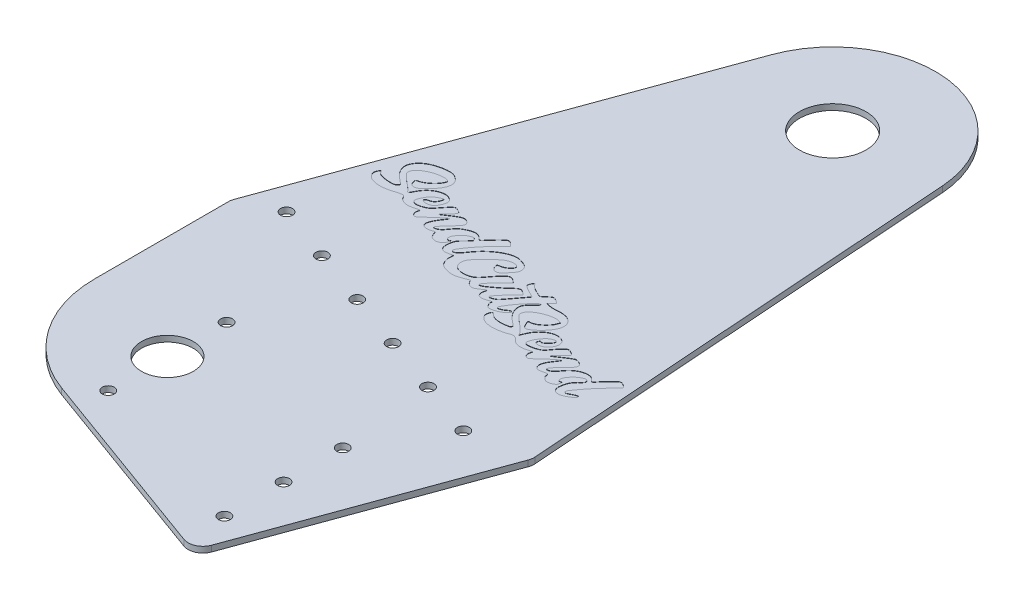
SolidWorks part; units mm, degrees
ref_plane "Front Plane" through (0, 0, 0) normal (0, 0, 1) x (1, 0, 0)
ref_plane "Top Plane" through (0, 0, 0) normal (0, 1, 0) x (1, 0, 0)
ref_plane "Right Plane" through (0, 0, 0) normal (1, 0, 0) x (0, 0, -1)
sketch "Sketch1" plane through (0, 0, 0) normal (0, 1, 0) x (1, 0, 0)
  line L2 (0, 79.9615) -> (0, 137.226)
  line L3 (160.847, 106.8323) -> (8.6873, 162.2139) construction
  line L9 (124.1351, 5.967) -> (160.3844, 105.5611)
  line L11 (0, 138.3457) -> (152.1597, 82.9641) construction
  line L12 (4.3437, 150.2798) -> (156.5034, 94.8982) construction
  line L13 (116.079, 82.9641) -> (116.079, 0) construction
  line L14 (128.779, 6.7641) -> (103.379, 6.7641) construction
  line L15 (128.779, 6.7641) -> (128.779, 82.9641) construction
  line L16 (128.779, 82.9641) -> (103.379, 82.9641) construction
  line L17 (103.379, 6.7641) -> (103.379, 82.9641) construction
  line L18 (128.779, 6.7641) -> (103.379, 82.9641) construction
  line L19 (128.779, 82.9641) -> (103.379, 6.7641) construction
  line L20 (0.383, 139.3979) -> (8.6873, 162.2139)
  line L21 (8.6873, 162.2139) -> (61.8971, 308.4066)
  line L22 (147.4128, 296.4285) -> (160.7514, 108.1817)
  line L23 (33.4254, 32.2252) -> (115.9962, 2.1718)
  line L24 (0, 0) -> (121.9633, 0) construction
  circle A0 centre (103.379, 293.3084) radius 14.2875
  circle A1 centre (44.45, 66.6217) radius 11.1125
  circle A2 centre (44.45, 66.6217) radius 25.4 construction
  circle A3 centre (44.45, 92.0217) radius 2.5527
  circle A4 centre (44.45, 41.2217) radius 2.5527
  circle A5 centre (44.45, 66.6217) radius 31.75 construction
  arc A6 (147.4128, 296.4285) -> (61.8971, 308.4066) centre (103.379, 293.3084) ccw
  arc A9 (0.383, 139.3979) -> (0, 137.226) centre (6.35, 137.226) ccw
  arc A10 (160.3844, 105.5611) -> (160.7514, 108.1817) centre (154.4173, 107.7329) ccw
  arc A11 (115.9962, 2.1718) -> (124.1351, 5.967) centre (118.168, 8.1389) ccw
  arc A12 (0, 79.9615) -> (33.4254, 32.2252) centre (50.8, 79.9615) ccw
  point P3 (111.7505, 111.1869)
  point P14 (135.6187, 102.4996)
  point P20 (116.079, 44.8641)
  point P24 (87.8823, 119.8742)
  point P26 (64.0141, 128.5615)
  point P28 (40.1459, 137.2488)
  point P29 (116.079, 19.4641)
  point P32 (16.2778, 145.9362)
  point P42 (0, 0)
  point P49 (116.079, 70.2641)
  dimension "D2" = 28.575
  dimension "D3" = 22.225
  dimension "D4" = 50.8
  dimension "D5" = 5.1054
  dimension "D21" = 63.5
  dimension "D22" = 6.35
  dimension "D26" = 50.8
  dimension "D6" = 20
  dimension "D7" = 25.4
  dimension "D8" = 23.3807
  dimension "D9" = 161.925
  dimension "D10" = 25.4
  dimension "D11" = 12.7
  dimension "D12" = 155.575
  dimension "D13" = 25.4
  dimension "D14" = 25.4
  dimension "D15" = 25.4
  dimension "D16" = 25.4
  dimension "D17" = 234.221
  dimension "D18" = 44.45
  dimension "D19" = 25.4
  dimension "D20" = 76.2
  dimension "D23" = 25.4
  dimension "D24" = 25.4
  dimension "D25" = 12.7
  dimension "D27" = 77.5957
extrude "Boss-Extrude1" add sketch "Sketch1" along normal blind 2.54
hole_wizard "#7 (0.201) Diameter Hole1" positions "Sketch2" profile "Sketch3" hole size "#7" standard "ANSI Inch"
sketch "Sketch2" plane through (0, 0, 0) normal (0, -1, 0) x (-1, 0, 0)
  point P0 (-135.6187, 102.4996)
  point P3 (-111.7505, 111.1869)
  point P6 (-87.8823, 119.8742)
  point P9 (-64.0141, 128.5615)
  point P12 (-40.1459, 137.2488)
  point P15 (-16.2778, 145.9362)
  point P18 (-116.079, 70.2641)
  point P21 (-116.079, 44.8641)
  point P24 (-116.079, 19.4641)
sketch "Sketch3" plane through (135.6187, 0, -102.4996) normal (1, 0, 0) x (0, 0, -1)
  line L0 (0, 0) -> (0, 2.54)
  line L1 (0, 2.54) -> (2.5527, 2.54)
  line L2 (2.5527, 2.54) -> (2.5527, 0)
  line L5 (2.5527, 0) -> (0, 0)
  line L11 (0, -6.35) -> (0, 107.95) construction
  dimension "Thru Hole Dia." = 5.1054
  dimension "Thru Hole Depth" = 2.54
sketch "Sketch7" plane through (0, 2.54, 0) normal (0, 1, 0) x (1, 0, 0)
  line L0 (62.0761, 169.3899) -> (62.5144, 170.567)
  line L1 (62.5144, 170.567) -> (61.5867, 170.2622)
  line L2 (66.9677, 175.195) -> (66.4796, 174.6886)
  line L3 (79.1731, 159.2722) -> (81.2123, 160.0556)
  line L4 (81.2123, 160.0556) -> (81.5639, 159.3016)
  line L5 (115.2098, 163.8413) -> (116.357, 163.4486)
  line L6 (116.357, 163.4486) -> (115.8813, 162.1889)
  line L7 (107.7827, 167.4695) -> (106.2875, 167.7994)
  line L8 (106.2875, 167.7994) -> (107.2664, 168.7114)
  line L9 (96.7548, 171.953) -> (96.1723, 172.7991)
  line L10 (96.1723, 172.7991) -> (95.6669, 171.9454)
  line L11 (100.3403, 166.7321) -> (97.6686, 163.2228)
  line L12 (89.4476, 166.3552) -> (91.3642, 168.2161)
  line L13 (91.3642, 168.2161) -> (90.6316, 168.886)
  line L14 (14.1169, 177.1315) -> (159.6183, 124.1733) construction
  line L15 (61.8971, 308.4066) -> (0.383, 139.3979) construction
  line L16 (160.7514, 108.1817) -> (147.4128, 296.4285) construction
  line L17 (33.4254, 32.2252) -> (115.9962, 2.1718) construction
  arc A0 (74.3082, 182.8504) -> (73.725, 182.5147) centre (74.7103, 181.4774) ccw
  arc A1 (73.725, 182.5147) -> (72.1718, 181.0017) centre (133.1992, 119.9033) ccw
  arc A2 (72.1718, 181.0017) -> (70.5314, 179.2921) centre (111.5899, 141.5378) ccw
  arc A3 (70.5314, 179.2921) -> (69.0762, 177.6244) centre (101.8392, 150.5038) ccw
  arc A4 (68.547, 177.0625) -> (69.0762, 177.6244) centre (64.4257, 181.474) ccw
  arc A5 (68.1985, 176.9514) -> (68.547, 177.0625) centre (68.2556, 177.3744) ccw
  arc A6 (67.7948, 177.1281) -> (68.1985, 176.9514) centre (68.3059, 177.7466) ccw
  arc A7 (66.8738, 177.9219) -> (67.7948, 177.1281) centre (86.4277, 199.6753) ccw
  arc A8 (66.8738, 177.9219) -> (65.9604, 178.4972) centre (64.7429, 175.5513) ccw
  arc A9 (65.9604, 178.4972) -> (64.9049, 178.7371) centre (64.7273, 175.5134) ccw
  arc A10 (64.9049, 178.7371) -> (63.6726, 178.6312) centre (64.6624, 174.336) ccw
  arc A11 (63.6726, 178.6312) -> (62.2317, 178.1778) centre (65.8385, 169.232) ccw
  arc A12 (62.2317, 178.1778) -> (60.6707, 177.4551) centre (68.6224, 162.3269) ccw
  arc A13 (60.6707, 177.4551) -> (59.5301, 176.703) centre (63.8858, 171.3384) ccw
  arc A14 (59.5301, 176.703) -> (58.5257, 175.7167) centre (64.2391, 170.9033) ccw
  arc A15 (58.5257, 175.7167) -> (57.3864, 174.2438) centre (75.6018, 161.3305) ccw
  arc A16 (56.7062, 173.3435) -> (57.3864, 174.2438) centre (42.2162, 184.9983) ccw
  arc A17 (56.1228, 172.7101) -> (56.7062, 173.3435) centre (51.6914, 177.3771) ccw
  arc A18 (55.5639, 172.2634) -> (56.1228, 172.7101) centre (53.2294, 175.7573) ccw
  arc A19 (54.9666, 171.9461) -> (55.5639, 172.2634) centre (53.6962, 175.0587) ccw
  arc A20 (54.5243, 171.7924) -> (54.9666, 171.9461) centre (53.293, 176.0466) ccw
  arc A21 (54.1163, 171.7066) -> (54.5243, 171.7924) centre (53.7472, 174.4772) ccw
  arc A22 (53.7901, 171.6904) -> (54.1163, 171.7066) centre (53.8553, 173.6659) ccw
  arc A23 (53.635, 171.7688) -> (53.7901, 171.6904) centre (53.7969, 171.8965) ccw
  arc A24 (53.5905, 172.1698) -> (53.635, 171.7688) centre (53.9344, 172.005) ccw
  arc A25 (54.0093, 172.8651) -> (53.5905, 172.1698) centre (57.4392, 170.3253) ccw
  arc A26 (54.9177, 173.9796) -> (54.0093, 172.8651) centre (66.4395, 163.6605) ccw
  arc A27 (56.8324, 176.0866) -> (54.9177, 173.9796) centre (201.8255, 42.4065) ccw
  arc A28 (56.8324, 176.0866) -> (58.6294, 178.1211) centre (10.0366, 219.2312) ccw
  arc A29 (58.6294, 178.1211) -> (59.308, 179.2325) centre (55.3883, 180.8631) ccw
  arc A30 (59.308, 179.2325) -> (59.3329, 180.0542) centre (58.2421, 179.6759) ccw
  arc A31 (59.3329, 180.0542) -> (58.8124, 180.8462) centre (57.5061, 179.4207) ccw
  arc A32 (58.8124, 180.8462) -> (57.7553, 181.5045) centre (56.5222, 178.3469) ccw
  arc A33 (57.7553, 181.5045) -> (56.6586, 181.6278) centre (56.9757, 179.5081) ccw
  arc A34 (56.6586, 181.6278) -> (55.3092, 181.1821) centre (57.2782, 177.4858) ccw
  arc A35 (55.3092, 181.1821) -> (53.3754, 180.0329) centre (66.6249, 159.9392) ccw
  arc A36 (50.4555, 178.11) -> (53.3754, 180.0329) centre (-1623.116, 2722.5471) ccw
  arc A37 (49.9624, 177.8143) -> (50.4555, 178.11) centre (46.648, 183.8988) ccw
  arc A38 (49.9101, 177.875) -> (49.9624, 177.8143) centre (49.9428, 177.8503) ccw
  arc A39 (50.3128, 178.3647) -> (49.9101, 177.875) centre (56.008, 173.2696) ccw
  arc A40 (50.6868, 178.776) -> (50.3128, 178.3647) centre (76.0211, 155.3656) ccw
  arc A41 (51.2355, 179.3665) -> (50.6868, 178.776) centre (157.5463, 80.0316) ccw
  arc A42 (51.843, 180.0132) -> (51.2355, 179.3665) centre (169.196, 69.1464) ccw
  arc A43 (52.4254, 180.6256) -> (51.843, 180.0132) centre (148.4427, 88.7526) ccw
  arc A44 (52.4254, 180.6256) -> (53.4057, 181.7377) centre (39.3118, 193.1732) ccw
  arc A45 (53.4057, 181.7377) -> (53.5985, 182.3391) centre (52.73, 182.286) ccw
  arc A46 (53.5985, 182.3391) -> (53.3133, 182.8365) centre (52.9532, 182.2996) ccw
  arc A47 (53.3133, 182.8365) -> (52.2525, 183.4524) centre (48.0293, 174.9565) ccw
  arc A48 (52.2525, 183.4524) -> (51.5201, 183.784) centre (47.2947, 173.4787) ccw
  arc A49 (51.5201, 183.784) -> (51.1138, 183.8533) centre (51.1621, 182.911) ccw
  arc A50 (51.1138, 183.8533) -> (50.7464, 183.7367) centre (51.1527, 183.0936) ccw
  arc A51 (50.7464, 183.7367) -> (50.2, 183.3471) centre (53.9544, 178.6599) ccw
  arc A52 (50.2, 183.3471) -> (49.7518, 182.9327) centre (52.8985, 179.9782) ccw
  arc A53 (49.7518, 182.9327) -> (49.0516, 182.1629) centre (73.6142, 160.5277) ccw
  arc A54 (49.0516, 182.1629) -> (48.2702, 181.2458) centre (76.593, 157.9039) ccw
  arc A55 (48.2702, 181.2458) -> (47.5086, 180.2915) centre (78.2622, 156.5282) ccw
  arc A56 (46.4851, 179.0185) -> (47.5086, 180.2915) centre (14.0592, 206.1378) ccw
  arc A57 (45.7613, 178.2653) -> (46.4851, 179.0185) centre (40.6676, 183.884) ccw
  arc A58 (45.0854, 177.7635) -> (45.7613, 178.2653) centre (42.8654, 181.4597) ccw
  arc A59 (44.2716, 177.3569) -> (45.0854, 177.7635) centre (42.0649, 182.7925) ccw
  arc A60 (42.4079, 176.7566) -> (44.2716, 177.3569) centre (39.29, 189.6277) ccw
  arc A61 (40.9063, 176.6373) -> (42.4079, 176.7566) centre (41.2837, 181.3973) ccw
  arc A62 (39.9018, 176.9889) -> (40.9063, 176.6373) centre (41.0714, 178.7199) ccw
  arc A63 (39.431, 177.7408) -> (39.9018, 176.9889) centre (40.5148, 177.8961) ccw
  arc A64 (39.5246, 178.6802) -> (39.431, 177.7408) centre (41.3834, 178.0206) ccw
  arc A65 (40.1422, 180.1498) -> (39.5246, 178.6802) centre (52.749, 173.9875) ccw
  arc A66 (40.967, 181.6069) -> (40.1422, 180.1498) centre (52.5933, 174.0636) ccw
  arc A67 (41.8093, 182.6065) -> (40.967, 181.6069) centre (45.3757, 178.7465) ccw
  arc A68 (42.735, 183.3116) -> (41.8093, 182.6065) centre (45.9761, 178.0966) ccw
  arc A69 (43.9637, 183.9848) -> (42.735, 183.3116) centre (49.4769, 172.4638) ccw
  arc A70 (45.1396, 184.492) -> (43.9637, 183.9848) centre (51.0302, 169.2179) ccw
  arc A71 (45.4706, 184.3586) -> (45.1396, 184.492) centre (45.2337, 184.2481) ccw
  arc A72 (45.4918, 184.1987) -> (45.4706, 184.3586) centre (45.2267, 184.2448) ccw
  arc A73 (45.4167, 183.8436) -> (45.4918, 184.1987) centre (40.5531, 185.0579) ccw
  arc A74 (45.2918, 183.4176) -> (45.4167, 183.8436) centre (40.1115, 185.1681) ccw
  arc A75 (45.1216, 182.9606) -> (45.2918, 183.4176) centre (37.7577, 185.9635) ccw
  arc A76 (44.6747, 182.1439) -> (45.1216, 182.9606) centre (41.315, 184.5129) ccw
  arc A77 (44.0662, 181.4742) -> (44.6747, 182.1439) centre (41.6698, 184.2628) ccw
  arc A78 (43.3406, 180.9981) -> (44.0662, 181.4742) centre (41.872, 184.0274) ccw
  arc A79 (42.5496, 180.7503) -> (43.3406, 180.9981) centre (42.1132, 183.5299) ccw
  arc A80 (42.5496, 180.7503) -> (42.0333, 180.6322) centre (43.1444, 176.9613) ccw
  arc A81 (42.0333, 180.6322) -> (41.6424, 180.4565) centre (42.5179, 179.0313) ccw
  arc A82 (41.6424, 180.4565) -> (41.3631, 180.2173) centre (42.2562, 179.4572) ccw
  arc A83 (41.3631, 180.2173) -> (41.1817, 179.91) centre (42.1574, 179.5413) ccw
  arc A84 (41.1817, 179.91) -> (41.3098, 179.5404) centre (41.4675, 179.802) ccw
  arc A85 (41.3098, 179.5404) -> (42.0184, 179.2356) centre (42.7766, 181.9744) ccw
  arc A86 (42.0184, 179.2356) -> (42.9911, 179.0785) centre (43.2169, 183.5653) ccw
  arc A87 (42.9911, 179.0785) -> (43.9333, 179.1484) centre (43.1825, 182.8819) ccw
  arc A88 (43.9333, 179.1484) -> (44.9037, 179.5156) centre (43.3041, 182.2773) ccw
  arc A89 (44.9037, 179.5156) -> (45.7482, 180.1858) centre (43.0455, 182.7238) ccw
  arc A90 (45.7482, 180.1858) -> (46.4656, 181.1717) centre (42.1809, 183.5357) ccw
  arc A91 (46.4656, 181.1717) -> (47.0588, 182.4767) centre (38.3652, 185.6409) ccw
  arc A92 (47.0588, 182.4767) -> (47.3717, 183.6741) centre (40.8285, 184.7444) ccw
  arc A93 (47.3717, 183.6741) -> (47.3128, 184.5787) centre (45.3846, 183.9991) ccw
  arc A94 (47.3128, 184.5787) -> (46.8711, 185.315) centre (45.6402, 184.0759) ccw
  arc A95 (46.8711, 185.315) -> (46.0042, 185.9854) centre (43.743, 182.166) ccw
  arc A96 (46.0042, 185.9854) -> (43.5248, 186.5796) centre (43.802, 182.2657) ccw
  arc A97 (43.5248, 186.5796) -> (40.6936, 185.808) centre (43.994, 179.2776) ccw
  arc A98 (40.6936, 185.808) -> (38.0435, 183.8254) centre (44.996, 177.2948) ccw
  arc A99 (38.0435, 183.8254) -> (36.1073, 180.9839) centre (46.1106, 176.2478) ccw
  arc A100 (35.7666, 180.3077) -> (36.1073, 180.9839) centre (22.1662, 187.5841) ccw
  arc A101 (35.4405, 179.7525) -> (35.7666, 180.3077) centre (28.6157, 184.1336) ccw
  arc A102 (35.1529, 179.3322) -> (35.4405, 179.7525) centre (28.1525, 184.4309) ccw
  arc A103 (35.0212, 179.292) -> (35.1529, 179.3322) centre (35.0603, 179.3996) ccw
  arc A104 (34.8987, 179.3634) -> (35.0212, 179.292) centre (35.1574, 179.6664) ccw
  arc A105 (34.7135, 179.5337) -> (34.8987, 179.3634) centre (37.1267, 181.9726) ccw
  arc A106 (34.5102, 179.7505) -> (34.7135, 179.5337) centre (37.4991, 182.3489) ccw
  arc A107 (34.3152, 179.9906) -> (34.5102, 179.7505) centre (38.0148, 182.7973) ccw
  arc A108 (34.3152, 179.9906) -> (33.9923, 180.3441) centre (32.2157, 178.3978) ccw
  arc A109 (33.9923, 180.3441) -> (33.1472, 181.1013) centre (-7.0589, 135.3727) ccw
  arc A110 (33.1472, 181.1013) -> (32.12, 181.9836) centre (-5.5235, 137.119) ccw
  arc A111 (32.12, 181.9836) -> (30.9902, 182.914) centre (-19.1906, 120.8302) ccw
  arc A112 (29.8644, 183.859) -> (30.9902, 182.914) centre (55.91, 213.7448) ccw
  arc A113 (28.849, 184.7853) -> (29.8644, 183.859) centre (49.7895, 206.7219) ccw
  arc A114 (28.0329, 185.5958) -> (28.849, 184.7853) centre (48.8821, 205.7713) ccw
  arc A115 (27.72, 186.0357) -> (28.0329, 185.5958) centre (29.3248, 186.846) ccw
  arc A116 (27.5634, 187.404) -> (27.72, 186.0357) centre (29.4953, 186.932) ccw
  arc A117 (28.2937, 188.8328) -> (27.5634, 187.404) centre (30.9404, 186.579) ccw
  arc A118 (29.9235, 190.2307) -> (28.2937, 188.8328) centre (33.5403, 184.365) ccw
  arc A119 (32.3635, 191.4887) -> (29.9235, 190.2307) centre (39.3462, 174.9492) ccw
  arc A120 (34.2055, 192.0999) -> (32.3635, 191.4887) centre (37.1375, 180.1808) ccw
  arc A121 (36.2347, 192.4587) -> (34.2055, 192.0999) centre (37.9264, 176.974) ccw
  arc A122 (38.0495, 192.5388) -> (36.2347, 192.4587) centre (37.761, 178.4879) ccw
  arc A123 (39.0536, 192.2197) -> (38.0495, 192.5388) centre (38.0113, 190.6797) ccw
  arc A124 (39.401, 191.9318) -> (39.0536, 192.2197) centre (37.7469, 190.289) ccw
  arc A125 (39.5146, 191.678) -> (39.401, 191.9318) centre (39.1218, 191.6545) ccw
  arc A126 (39.4565, 191.3418) -> (39.5146, 191.678) centre (38.7713, 191.6335) ccw
  arc A127 (39.1465, 190.6692) -> (39.4565, 191.3418) centre (27.8847, 196.2671) ccw
  arc A128 (38.0069, 188.9592) -> (39.1465, 190.6692) centre (31.8572, 194.2925) ccw
  arc A129 (36.3742, 187.4082) -> (38.0069, 188.9592) centre (29.1898, 196.6058) ccw
  arc A130 (34.4963, 186.2162) -> (36.3742, 187.4082) centre (29.3429, 196.4098) ccw
  arc A131 (32.6257, 185.5753) -> (34.4963, 186.2162) centre (31.2535, 192.6306) ccw
  arc A132 (32.6257, 185.5753) -> (32.326, 185.4734) centre (32.849, 184.4267) ccw
  arc A133 (32.326, 185.4734) -> (32.1971, 185.3132) centre (32.4364, 185.2526) ccw
  arc A134 (32.1971, 185.3132) -> (32.187, 185.0278) centre (32.8524, 185.1473) ccw
  arc A135 (32.187, 185.0278) -> (32.3205, 184.3701) centre (46.8553, 187.6615) ccw
  arc A136 (32.3205, 184.3701) -> (32.6327, 183.5397) centre (35.4909, 185.088) ccw
  arc A137 (32.6327, 183.5397) -> (33.1345, 182.9292) centre (34.4573, 184.5281) ccw
  arc A138 (33.1345, 182.9292) -> (33.7845, 182.5919) centre (34.2412, 184.2668) ccw
  arc A139 (33.7845, 182.5919) -> (34.5255, 182.546) centre (34.2659, 184.3575) ccw
  arc A140 (34.5255, 182.546) -> (36.1223, 183.2401) centre (34.0587, 185.8032) ccw
  arc A141 (36.1223, 183.2401) -> (38.2538, 185.2006) centre (22.3005, 200.4074) ccw
  arc A142 (38.2538, 185.2006) -> (40.2061, 187.5541) centre (22.1985, 200.5047) ccw
  arc A143 (40.2061, 187.5541) -> (41.3352, 189.6901) centre (33.0357, 192.7108) ccw
  arc A144 (41.3352, 189.6901) -> (41.6737, 191.3689) centre (35.9537, 191.6488) ccw
  arc A145 (41.6737, 191.3689) -> (41.4198, 192.8507) centre (38.2108, 191.5384) ccw
  arc A146 (41.4198, 192.8507) -> (40.543, 194.1499) centre (37.865, 191.397) ccw
  arc A147 (40.543, 194.1499) -> (39.0445, 195.2909) centre (35.0939, 188.5481) ccw
  arc A148 (39.0445, 195.2909) -> (36.5392, 195.9699) centre (36.5427, 191.021) ccw
  arc A149 (36.5392, 195.9699) -> (32.9739, 195.586) centre (36.5513, 179.1093) ccw
  arc A150 (32.9739, 195.586) -> (29.3635, 194.3985) centre (36.8595, 177.6898) ccw
  arc A151 (29.3635, 194.3985) -> (26.6543, 192.6008) centre (33.4359, 185.3211) ccw
  arc A152 (26.6543, 192.6008) -> (24.9307, 190.1375) centre (31.5632, 187.3313) ccw
  arc A153 (24.9307, 190.1375) -> (24.6835, 187.5211) centre (28.9468, 188.4382) ccw
  arc A154 (24.6835, 187.5211) -> (26.0207, 184.7839) centre (30.8844, 188.8551) ccw
  arc A155 (26.0207, 184.7839) -> (28.9405, 181.9734) centre (40.4964, 196.9008) ccw
  arc A156 (29.9885, 181.128) -> (28.9405, 181.9734) centre (8.4014, 155.4417) ccw
  arc A157 (30.3575, 180.6787) -> (29.9885, 181.128) centre (28.9675, 179.9132) ccw
  arc A158 (30.3713, 180.3133) -> (30.3575, 180.6787) centre (30.0009, 180.4823) ccw
  arc A159 (30.0759, 179.9118) -> (30.3713, 180.3133) centre (29.2641, 180.8183) ccw
  arc A160 (28.5512, 179.2654) -> (30.0759, 179.9118) centre (28.3681, 181.8189) ccw
  arc A161 (25.8887, 179.3109) -> (28.5512, 179.2654) centre (27.4758, 194.2586) ccw
  arc A162 (23.2563, 179.8312) -> (25.8887, 179.3109) centre (27.4762, 194.2617) ccw
  arc A163 (21.8803, 180.7864) -> (23.2563, 179.8312) centre (23.9984, 182.369) ccw
  arc A164 (21.8803, 180.7864) -> (21.4146, 181.3746) centre (11.131, 172.7548) ccw
  arc A165 (21.4146, 181.3746) -> (21.194, 181.4707) centre (21.208, 181.2014) ccw
  arc A166 (21.194, 181.4707) -> (20.9847, 181.3519) centre (21.2079, 181.2022) ccw
  arc A167 (20.9847, 181.3519) -> (20.5852, 180.7185) centre (32.0578, 173.9268) ccw
  arc A168 (20.5852, 180.7185) -> (20.5596, 178.2742) centre (22.6871, 179.4742) ccw
  arc A169 (20.5596, 178.2742) -> (22.7566, 176.3693) centre (24.3256, 180.3983) ccw
  arc A170 (22.7566, 176.3693) -> (26.8636, 175.665) centre (26.5339, 186.0688) ccw
  arc A171 (26.8636, 175.665) -> (31.4496, 176.4875) centre (26.3557, 191.6925) ccw
  arc A172 (32.2098, 176.7264) -> (31.4496, 176.4875) centre (38.1788, 156.4012) ccw
  arc A173 (33.0182, 176.9497) -> (32.2098, 176.7264) centre (39.5156, 151.8489) ccw
  arc A174 (33.7585, 177.1285) -> (33.0182, 176.9497) centre (38.8624, 154.3726) ccw
  arc A175 (34.2819, 177.2207) -> (33.7585, 177.1285) centre (35.0169, 171.5178) ccw
  arc A176 (34.9396, 177.2772) -> (34.2819, 177.2207) centre (35.2749, 169.5161) ccw
  arc A177 (35.2649, 177.2034) -> (34.9396, 177.2772) centre (34.967, 176.6436) ccw
  arc A178 (35.5206, 176.9724) -> (35.2649, 177.2034) centre (34.9322, 176.5782) ccw
  arc A179 (35.9024, 176.3582) -> (35.5206, 176.9724) centre (26.6812, 171.0512) ccw
  arc A180 (35.9024, 176.3582) -> (36.9988, 175.1864) centre (38.9535, 178.1142) ccw
  arc A181 (36.9988, 175.1864) -> (38.571, 174.5314) centre (39.4525, 178.8615) ccw
  arc A182 (38.571, 174.5314) -> (40.5484, 174.4493) centre (39.8152, 180.6435) ccw
  arc A183 (40.5484, 174.4493) -> (42.8178, 174.9505) centre (39.1738, 186.0622) ccw
  arc A184 (43.3201, 175.1069) -> (42.8178, 174.9505) centre (48.2695, 158.3264) ccw
  arc A185 (43.7701, 175.2291) -> (43.3201, 175.1069) centre (46.3835, 164.7208) ccw
  arc A186 (44.1476, 175.3175) -> (43.7701, 175.2291) centre (47.1628, 161.587) ccw
  arc A187 (44.2628, 175.3098) -> (44.1476, 175.3175) centre (44.192, 175.1153) ccw
  arc A188 (44.3107, 175.241) -> (44.2628, 175.3098) centre (44.2379, 175.2415) ccw
  arc A189 (44.2954, 175.0356) -> (44.3107, 175.241) centre (42.7889, 175.2514) ccw
  arc A190 (44.2393, 174.7674) -> (44.2954, 175.0356) centre (42.1713, 175.3398) ccw
  arc A191 (44.1412, 174.4607) -> (44.2393, 174.7674) centre (40.311, 175.8548) ccw
  arc A192 (44.1412, 174.4607) -> (44.0089, 173.708) centre (46.203, 173.7103) ccw
  arc A193 (44.0089, 173.708) -> (44.1385, 172.9419) centre (46.3511, 173.7104) ccw
  arc A194 (44.1385, 172.9419) -> (44.5028, 172.2883) centre (46.1785, 173.6505) ccw
  arc A195 (44.5028, 172.2883) -> (45.0452, 171.8581) centre (45.7458, 173.2987) ccw
  arc A196 (45.0452, 171.8581) -> (45.5046, 171.7887) centre (45.3862, 172.5592) ccw
  arc A197 (45.5046, 171.7887) -> (46.0003, 171.9763) centre (45.311, 173.0486) ccw
  arc A198 (46.0003, 171.9763) -> (46.7213, 172.5276) centre (42.9825, 176.6707) ccw
  arc A199 (46.7213, 172.5276) -> (48.1908, 173.8802) centre (-21.0634, 247.6437) ccw
  arc A200 (49.9531, 175.4754) -> (48.1908, 173.8802) centre (92.8617, 126.3005) ccw
  arc A201 (51.74, 176.975) -> (49.9531, 175.4754) centre (89.7982, 129.8115) ccw
  arc A202 (53.4092, 178.3032) -> (51.74, 176.975) centre (149.5534, 55.76) ccw
  arc A203 (53.7366, 178.3554) -> (53.4092, 178.3032) centre (53.6199, 178.0346) ccw
  arc A204 (53.756, 178.2996) -> (53.7366, 178.3554) centre (53.7236, 178.3196) ccw
  arc A205 (53.4455, 177.8028) -> (53.756, 178.2996) centre (14.1169, 202.725) ccw
  arc A206 (53.0612, 177.2191) -> (53.4455, 177.8028) centre (36.5165, 188.5306) ccw
  arc A207 (52.5822, 176.5337) -> (53.0612, 177.2191) centre (19.3352, 200.2773) ccw
  arc A208 (52.5822, 176.5337) -> (51.6189, 175.0333) centre (67.2678, 166.0458) ccw
  arc A209 (51.6189, 175.0333) -> (50.8843, 173.5493) centre (63.2726, 168.3404) ccw
  arc A210 (50.8843, 173.5493) -> (50.4332, 172.233) centre (60.3416, 169.5728) ccw
  arc A211 (50.4332, 172.233) -> (50.3764, 171.2877) centre (52.709, 171.622) ccw
  arc A212 (50.3764, 171.2877) -> (50.8293, 170.4134) centre (51.8564, 171.4998) ccw
  arc A213 (50.8293, 170.4134) -> (51.7794, 169.8973) centre (52.2752, 171.9427) ccw
  arc A214 (51.7794, 169.8973) -> (53.1461, 169.8276) centre (52.647, 173.4767) ccw
  arc A215 (53.1461, 169.8276) -> (54.7542, 170.2266) centre (52.0974, 177.4948) ccw
  arc A216 (55.3189, 170.4157) -> (54.7542, 170.2266) centre (58.4979, 159.9846) ccw
  arc A217 (55.6177, 170.4524) -> (55.3189, 170.4157) centre (55.573, 169.5819) ccw
  arc A218 (55.7691, 170.3669) -> (55.6177, 170.4524) centre (55.6077, 170.2581) ccw
  arc A219 (55.8258, 170.1715) -> (55.7691, 170.3669) centre (55.4927, 170.1806) ccw
  arc A220 (55.8258, 170.1715) -> (55.8514, 169.9319) centre (56.7312, 170.1468) ccw
  arc A221 (55.8514, 169.9319) -> (55.9579, 169.5508) centre (61.6551, 171.3493) ccw
  arc A222 (55.9579, 169.5508) -> (56.1102, 169.1191) centre (62.5193, 171.6221) ccw
  arc A223 (56.1102, 169.1191) -> (56.2928, 168.6924) centre (62.8661, 171.7576) ccw
  arc A224 (56.2928, 168.6924) -> (57.4829, 167.4515) centre (58.71, 169.8196) ccw
  arc A225 (57.4829, 167.4515) -> (59.2339, 167.1346) centre (58.8722, 170.1326) ccw
  arc A226 (59.2339, 167.1346) -> (60.9662, 167.8594) centre (58.8215, 170.5531) ccw
  arc A227 (60.9662, 167.8594) -> (62.0761, 169.3899) centre (58.7665, 170.6222) ccw
  arc A228 (60.6138, 170.7928) -> (61.5867, 170.2622) centre (61.3494, 170.9844) ccw
  arc A229 (60.8154, 172.4171) -> (60.6138, 170.7928) centre (62.7575, 171.3513) ccw
  arc A230 (62.6398, 174.8337) -> (60.8154, 172.4171) centre (70.0177, 167.367) ccw
  arc A231 (64.8718, 176.2485) -> (62.6398, 174.8337) centre (67.003, 170.418) ccw
  arc A232 (65.3282, 176.4029) -> (64.8718, 176.2485) centre (68.2976, 166.8761) ccw
  arc A233 (65.749, 176.5194) -> (65.3282, 176.4029) centre (67.3605, 169.8827) ccw
  arc A234 (66.1032, 176.5955) -> (65.749, 176.5194) centre (67.3446, 169.9483) ccw
  arc A235 (66.2518, 176.5832) -> (66.1032, 176.5955) centre (66.1551, 176.3175) ccw
  arc A236 (66.44, 176.4345) -> (66.2518, 176.5832) centre (66.1213, 176.2247) ccw
  arc A237 (66.7316, 175.9559) -> (66.44, 176.4345) centre (59.7592, 172.036) ccw
  arc A238 (66.9914, 175.457) -> (66.7316, 175.9559) centre (59.0868, 171.658) ccw
  arc A239 (67.0017, 175.2495) -> (66.9914, 175.457) centre (66.7501, 175.3411) ccw
  arc A240 (66.9677, 175.195) -> (67.0017, 175.2495) centre (66.8559, 175.3025) ccw
  arc A241 (65.9217, 174.1157) -> (66.4796, 174.6886) centre (-0.3358, 239.1998) ccw
  arc A242 (65.2645, 173.4503) -> (65.9217, 174.1157) centre (-57.3273, 295.182) ccw
  arc A243 (65.2645, 173.4503) -> (64.0677, 172.1499) centre (81.8084, 157.0225) ccw
  arc A244 (64.0677, 172.1499) -> (63.4286, 171.1774) centre (67.6274, 169.1145) ccw
  arc A245 (63.4286, 171.1774) -> (63.0742, 170.1165) centre (67.1785, 169.3351) ccw
  arc A246 (63.0742, 170.1165) -> (62.8538, 168.5433) centre (79.0298, 167.0787) ccw
  arc A247 (62.8538, 168.5433) -> (62.9704, 166.7394) centre (68.6902, 168.0148) ccw
  arc A248 (62.9704, 166.7394) -> (63.6889, 165.5617) centre (65.0575, 167.2048) ccw
  arc A249 (63.6889, 165.5617) -> (64.9741, 165.071) centre (65.0485, 167.194) ccw
  arc A250 (64.9741, 165.071) -> (66.7601, 165.2889) centre (65.1764, 170.8417) ccw
  arc A251 (67.3237, 165.441) -> (66.7601, 165.2889) centre (72.4207, 145.443) ccw
  arc A252 (67.8029, 165.5512) -> (67.3237, 165.441) centre (69.904, 155.3172) ccw
  arc A253 (68.2017, 165.6286) -> (67.8029, 165.5512) centre (71.5525, 147.2877) ccw
  arc A254 (68.2539, 165.5956) -> (68.2017, 165.6286) centre (68.2099, 165.5838) ccw
  arc A255 (68.2632, 165.5138) -> (68.2539, 165.5956) centre (67.9851, 165.5235) ccw
  arc A256 (68.2486, 165.1392) -> (68.2632, 165.5138) centre (18.2975, 167.2726) ccw
  arc A257 (68.2263, 164.699) -> (68.2486, 165.1392) centre (40.5629, 166.3217) ccw
  arc A258 (68.1942, 164.1979) -> (68.2263, 164.699) centre (21.7421, 167.4257) ccw
  arc A259 (68.1942, 164.1979) -> (68.2557, 162.9509) centre (73.4553, 163.8323) ccw
  arc A260 (68.2557, 162.9509) -> (68.6061, 161.6871) centre (74.5732, 164.0218) ccw
  arc A261 (68.6061, 161.6871) -> (69.1861, 160.5706) centre (74.1315, 163.849) ccw
  arc A262 (69.1861, 160.5706) -> (69.9292, 159.7637) centre (72.0774, 162.4873) ccw
  arc A263 (69.9292, 159.7637) -> (71.0506, 159.11) centre (72.8077, 163.4132) ccw
  arc A264 (71.0506, 159.11) -> (72.6135, 158.5966) centre (75.4812, 169.9608) ccw
  arc A265 (72.6135, 158.5966) -> (74.2686, 158.2998) centre (75.5651, 170.2933) ccw
  arc A266 (74.2686, 158.2998) -> (75.6874, 158.3104) centre (74.932, 164.4372) ccw
  arc A267 (75.6874, 158.3104) -> (76.3847, 158.4332) centre (74.8472, 165.1251) ccw
  arc A268 (76.3847, 158.4332) -> (77.308, 158.6665) centre (71.4689, 179.8295) ccw
  arc A269 (77.308, 158.6665) -> (78.2865, 158.9591) centre (70.9596, 181.6752) ccw
  arc A270 (78.2865, 158.9591) -> (79.1731, 159.2722) centre (73.0176, 175.2945) ccw
  arc A271 (81.5639, 159.3016) -> (82.0723, 158.5817) centre (83.8133, 160.3506) ccw
  arc A272 (82.0723, 158.5817) -> (82.8503, 157.998) centre (84.6282, 161.1785) ccw
  arc A273 (82.8503, 157.998) -> (83.7221, 157.6587) centre (84.503, 160.9544) ccw
  arc A274 (83.7221, 157.6587) -> (84.5041, 157.658) centre (84.1145, 159.3147) ccw
  arc A275 (84.5041, 157.658) -> (84.898, 157.7963) centre (84.055, 159.5674) ccw
  arc A276 (84.898, 157.7963) -> (85.4779, 158.094) centre (80.2438, 167.5753) ccw
  arc A277 (85.4779, 158.094) -> (86.1162, 158.4718) centre (79.4906, 168.9396) ccw
  arc A278 (86.1162, 158.4718) -> (86.7275, 158.8854) centre (79.669, 168.6578) ccw
  arc A279 (87.2967, 159.2808) -> (86.7275, 158.8854) centre (97.7406, 143.6379) ccw
  arc A280 (87.8098, 159.6034) -> (87.2967, 159.2808) centre (93.4193, 150.1105) ccw
  arc A281 (88.2441, 159.8499) -> (87.8098, 159.6034) centre (95.1182, 147.2354) ccw
  arc A282 (88.3811, 159.8626) -> (88.2441, 159.8499) centre (88.3273, 159.6972) ccw
  arc A283 (88.4414, 159.7807) -> (88.3811, 159.8626) centre (88.3541, 159.7795) ccw
  arc A284 (88.427, 159.5386) -> (88.4414, 159.7807) centre (86.7915, 159.7576) ccw
  arc A285 (88.3624, 159.22) -> (88.427, 159.5386) centre (86.0178, 159.8612) ccw
  arc A286 (88.2462, 158.8546) -> (88.3624, 159.22) centre (83.8571, 160.4521) ccw
  arc A287 (88.2462, 158.8546) -> (88.1272, 158.3962) centre (90.5899, 158.0016) ccw
  arc A288 (88.1272, 158.3962) -> (88.0913, 157.9067) centre (90.9602, 157.9422) ccw
  arc A289 (88.0913, 157.9067) -> (88.1393, 157.4142) centre (91.0105, 157.9429) ccw
  arc A290 (88.1393, 157.4142) -> (88.2697, 156.946) centre (90.8101, 157.906) ccw
  arc A291 (88.2697, 156.946) -> (88.5079, 156.4198) centre (92.5095, 158.5481) ccw
  arc A292 (88.5079, 156.4198) -> (88.7537, 156.1203) centre (89.3753, 156.8811) ccw
  arc A293 (88.7537, 156.1203) -> (89.0958, 155.9389) centre (89.378, 156.8844) ccw
  arc A294 (89.0958, 155.9389) -> (89.6608, 155.8086) centre (90.4086, 160.338) ccw
  arc A295 (89.6608, 155.8086) -> (90.1565, 155.7817) centre (90.0307, 158.0495) ccw
  arc A296 (90.1565, 155.7817) -> (90.8132, 155.8497) centre (89.7737, 162.6832) ccw
  arc A297 (90.8132, 155.8497) -> (91.5106, 155.9893) centre (89.6645, 163.4011) ccw
  arc A298 (91.5106, 155.9893) -> (92.1441, 156.1863) centre (90.1128, 161.6014) ccw
  arc A299 (93.2212, 156.5738) -> (92.1441, 156.1863) centre (107.0085, 116.5611) ccw
  arc A300 (93.653, 156.6471) -> (93.2212, 156.5738) centre (93.6592, 155.3025) ccw
  arc A301 (93.8054, 156.5151) -> (93.653, 156.6471) centre (93.6537, 156.494) ccw
  arc A302 (93.7714, 156.1938) -> (93.8054, 156.5151) centre (93.1422, 156.4228) ccw
  arc A303 (93.7714, 156.1938) -> (93.7529, 155.6122) centre (94.648, 155.8748) ccw
  arc A304 (93.7529, 155.6122) -> (94.0829, 154.8096) centre (97.7329, 156.7795) ccw
  arc A305 (94.0829, 154.8096) -> (94.5832, 154.0778) centre (97.8126, 156.8225) ccw
  arc A306 (94.5832, 154.0778) -> (95.112, 153.71) centre (95.5427, 154.8932) ccw
  arc A307 (95.112, 153.71) -> (96.1172, 153.5975) centre (95.8467, 155.7286) ccw
  arc A308 (96.1172, 153.5975) -> (97.5577, 153.9024) centre (94.9894, 162.4836) ccw
  arc A309 (97.5577, 153.9024) -> (99.0889, 154.4962) centre (94.5811, 163.8479) ccw
  arc A310 (99.0889, 154.4962) -> (100.4205, 155.2988) centre (95.4623, 162.0198) ccw
  arc A311 (100.4205, 155.2988) -> (101.005, 155.7598) centre (93.571, 164.5834) ccw
  arc A312 (101.005, 155.7598) -> (101.4861, 156.2055) centre (96.5124, 161.0922) ccw
  arc A313 (101.4861, 156.2055) -> (101.8369, 156.5933) centre (96.9623, 160.6501) ccw
  arc A314 (101.8369, 156.5933) -> (101.8862, 156.7905) centre (101.657, 156.743) ccw
  arc A315 (101.8862, 156.7905) -> (101.6772, 157.1413) centre (101.2743, 156.6636) ccw
  arc A316 (101.6772, 157.1413) -> (101.3093, 157.2626) centre (101.3422, 156.7441) ccw
  arc A317 (101.3093, 157.2626) -> (100.7828, 157.1091) centre (101.3888, 156.0107) ccw
  arc A318 (100.7828, 157.1091) -> (100.1358, 156.6795) centre (103.0724, 152.9588) ccw
  arc A319 (99.2924, 156.1129) -> (100.1358, 156.6795) centre (96.0217, 161.8922) ccw
  arc A320 (98.3794, 155.687) -> (99.2924, 156.1129) centre (96.1294, 161.7019) ccw
  arc A321 (97.5854, 155.4596) -> (98.3794, 155.687) centre (96.5488, 160.5808) ccw
  arc A322 (97.2265, 155.5913) -> (97.5854, 155.4596) centre (97.513, 155.8174) ccw
  arc A323 (97.1513, 156.3756) -> (97.2265, 155.5913) centre (97.7972, 156.0417) ccw
  arc A324 (98.3117, 158.4158) -> (97.1513, 156.3756) centre (123.2009, 142.9097) ccw
  arc A325 (100.0065, 160.8692) -> (98.3117, 158.4158) centre (125.0369, 141.7659) ccw
  arc A326 (102.1792, 163.5408) -> (100.0065, 160.8692) centre (144.3604, 127.018) ccw
  arc A327 (103.5171, 165.0485) -> (102.1792, 163.5408) centre (164.7872, 109.3315) ccw
  arc A328 (104.2773, 165.7708) -> (103.5171, 165.0485) centre (108.8368, 160.211) ccw
  arc A329 (104.8168, 166.0837) -> (104.2773, 165.7708) centre (105.5083, 164.2697) ccw
  arc A330 (105.2843, 166.0873) -> (104.8168, 166.0837) centre (105.0553, 165.458) ccw
  arc A331 (105.3465, 165.9273) -> (105.2843, 166.0873) centre (105.2453, 165.98) ccw
  arc A332 (105.0939, 165.5331) -> (105.3465, 165.9273) centre (103.0097, 167.1464) ccw
  arc A333 (104.5868, 164.9464) -> (105.0939, 165.5331) centre (99.4276, 169.919) ccw
  arc A334 (103.7536, 164.1096) -> (104.5868, 164.9464) centre (78.4434, 190.1439) ccw
  arc A335 (103.7536, 164.1096) -> (102.3738, 162.6584) centre (121.5081, 145.8473) ccw
  arc A336 (102.3738, 162.6584) -> (101.6815, 161.5964) centre (105.712, 159.7254) ccw
  arc A337 (101.6815, 161.5964) -> (101.4294, 160.5657) centre (104.1682, 160.4421) ccw
  arc A338 (101.4294, 160.5657) -> (101.5169, 159.2913) centre (107.0552, 160.3118) ccw
  arc A339 (101.5169, 159.2913) -> (102.0068, 157.7779) centre (107.5122, 160.396) ccw
  arc A340 (102.0068, 157.7779) -> (102.9056, 156.2974) centre (109.7048, 161.4387) ccw
  arc A341 (102.9056, 156.2974) -> (104.2497, 154.8037) centre (112.3119, 163.41) ccw
  arc A342 (104.2497, 154.8037) -> (106.0867, 153.2478) centre (120.7155, 172.3809) ccw
  arc A343 (107.1588, 152.2758) -> (106.0867, 153.2478) centre (100.8303, 146.373) ccw
  arc A344 (107.2427, 151.6389) -> (107.1588, 152.2758) centre (106.7543, 151.8985) ccw
  arc A345 (106.625, 151.1698) -> (107.2427, 151.6389) centre (106.4259, 152.0731) ccw
  arc A346 (104.8179, 150.8612) -> (106.625, 151.1698) centre (102.4977, 169.8959) ccw
  arc A347 (102.932, 150.7695) -> (104.8179, 150.8612) centre (103.2457, 163.759) ccw
  arc A348 (101.2302, 150.9765) -> (102.932, 150.7695) centre (103.146, 159.6295) ccw
  arc A349 (99.8263, 151.4569) -> (101.2302, 150.9765) centre (102.6676, 157.4686) ccw
  arc A350 (98.8346, 152.1859) -> (99.8263, 151.4569) centre (101.2015, 154.3666) ccw
  arc A351 (98.8346, 152.1859) -> (98.2533, 152.7414) centre (94.1824, 147.8996) ccw
  arc A352 (98.2533, 152.7414) -> (97.9025, 152.8128) centre (98.0124, 152.455) ccw
  arc A353 (97.9025, 152.8128) -> (97.6086, 152.5576) centre (98.0436, 152.3534) ccw
  arc A354 (97.6086, 152.5576) -> (97.2521, 151.7001) centre (106.9734, 148.1619) ccw
  arc A355 (97.2521, 151.7001) -> (97.5139, 149.4925) centre (99.5718, 150.8558) ccw
  arc A356 (97.5139, 149.4925) -> (99.5568, 147.833) centre (101.185, 151.9245) ccw
  arc A357 (99.5568, 147.833) -> (103.1248, 147.1564) centre (103.0872, 156.7047) ccw
  arc A358 (103.1248, 147.1564) -> (107.3336, 147.6883) centre (103.0561, 164.6175) ccw
  arc A359 (107.3336, 147.6883) -> (108.1157, 147.8984) centre (100.7179, 173.8716) ccw
  arc A360 (108.1157, 147.8984) -> (108.8582, 148.1237) centre (101.8914, 169.7516) ccw
  arc A361 (108.8582, 148.1237) -> (109.4811, 148.3352) centre (102.4455, 168.0313) ccw
  arc A362 (109.4811, 148.3352) -> (109.7929, 148.4805) centre (108.8578, 150.0801) ccw
  arc A363 (110.551, 148.7041) -> (109.7929, 148.4805) centre (110.6245, 147.058) ccw
  arc A364 (111.4377, 148.592) -> (110.551, 148.7041) centre (110.6686, 146.0707) ccw
  arc A365 (112.3117, 148.1686) -> (111.4377, 148.592) centre (110.5204, 145.5849) ccw
  arc A366 (113.0306, 147.4929) -> (112.3117, 148.1686) centre (110.4085, 145.4234) ccw
  arc A367 (113.0306, 147.4929) -> (114.0876, 146.5636) centre (116.0922, 149.9093) ccw
  arc A368 (114.0876, 146.5636) -> (115.4418, 146.0301) centre (116.3711, 150.3749) ccw
  arc A369 (115.4418, 146.0301) -> (117.0635, 145.9201) centre (116.6348, 151.6077) ccw
  arc A370 (117.0635, 145.9201) -> (118.9045, 146.2365) centre (116.3233, 155.7421) ccw
  arc A371 (119.6917, 146.4433) -> (118.9045, 146.2365) centre (131.9567, 98.1706) ccw
  arc A372 (120.3794, 146.609) -> (119.6917, 146.4433) centre (126.7001, 118.8596) ccw
  arc A373 (120.9676, 146.7397) -> (120.3794, 146.609) centre (133.1775, 90.4219) ccw
  arc A374 (121.0804, 146.7321) -> (120.9676, 146.7397) centre (121.0107, 146.5407) ccw
  arc A375 (121.1231, 146.6671) -> (121.0804, 146.7321) centre (121.0581, 146.6709) ccw
  arc A376 (121.0986, 146.4529) -> (121.1231, 146.6671) centre (119.1481, 146.784) ccw
  arc A377 (121.0356, 146.1763) -> (121.0986, 146.4529) centre (118.6024, 146.8766) ccw
  arc A378 (120.9321, 145.8584) -> (121.0356, 146.1763) centre (116.3671, 147.5199) ccw
  arc A379 (120.9321, 145.8584) -> (120.8158, 145.1098) centre (122.7691, 145.1898) ccw
  arc A380 (120.8158, 145.1098) -> (120.9839, 144.3398) centre (123.0909, 145.2029) ccw
  arc A381 (120.9839, 144.3398) -> (121.3948, 143.698) centre (122.9451, 145.1432) ccw
  arc A382 (121.3948, 143.698) -> (121.9741, 143.3145) centre (122.4829, 144.7123) ccw
  arc A383 (121.9741, 143.3145) -> (122.4116, 143.2933) centre (122.227, 144.0094) ccw
  arc A384 (122.4116, 143.2933) -> (122.903, 143.5132) centre (122.0109, 144.8479) ccw
  arc A385 (122.903, 143.5132) -> (123.5919, 144.0558) centre (119.7757, 148.1925) ccw
  arc A386 (123.5919, 144.0558) -> (124.811, 145.2104) centre (80.2806, 191.0049) ccw
  arc A387 (126.4824, 146.7421) -> (124.811, 145.2104) centre (151.5098, 117.7536) ccw
  arc A388 (128.4014, 148.3252) -> (126.4824, 146.7421) centre (162.7367, 104.7499) ccw
  arc A389 (130.2861, 149.7873) -> (128.4014, 148.3252) centre (225.7864, 24.7328) ccw
  arc A390 (130.5402, 149.7248) -> (130.2861, 149.7873) centre (130.388, 149.6538) ccw
  arc A391 (130.535, 149.6327) -> (130.5402, 149.7248) centre (130.4519, 149.6836) ccw
  arc A392 (130.2239, 149.1328) -> (130.535, 149.6327) centre (93.2029, 172.5145) ccw
  arc A393 (129.8432, 148.5525) -> (130.2239, 149.1328) centre (113.206, 159.8809) ccw
  arc A394 (129.3801, 147.888) -> (129.8432, 148.5525) centre (99.0798, 169.4996) ccw
  arc A395 (129.3801, 147.888) -> (128.2705, 146.1509) centre (145.8021, 136.1751) ccw
  arc A396 (128.2705, 146.1509) -> (127.5947, 144.6382) centre (135.6907, 141.9286) ccw
  arc A397 (127.5947, 144.6382) -> (127.3428, 143.3653) centre (132.4287, 143.0204) ccw
  arc A398 (127.3428, 143.3653) -> (127.5302, 142.3605) centre (129.3875, 143.2266) ccw
  arc A399 (127.5302, 142.3605) -> (128.0096, 141.6309) centre (130.2673, 143.6369) ccw
  arc A400 (128.0096, 141.6309) -> (128.5887, 141.2752) centre (128.8878, 142.4112) ccw
  arc A401 (128.5887, 141.2752) -> (129.4221, 141.2292) centre (129.1175, 143.2836) ccw
  arc A402 (129.4221, 141.2292) -> (130.7955, 141.5008) centre (127.2837, 155.6505) ccw
  arc A403 (131.888, 141.7559) -> (130.7955, 141.5008) centre (140.5263, 102.2936) ccw
  arc A404 (132.3361, 141.7843) -> (131.888, 141.7559) centre (132.2048, 140.3084) ccw
  arc A405 (132.5874, 141.6517) -> (132.3361, 141.7843) centre (132.3035, 141.4182) ccw
  arc A406 (132.763, 141.3258) -> (132.5874, 141.6517) centre (131.8466, 141.0423) ccw
  arc A407 (132.8313, 141.0753) -> (132.763, 141.3258) centre (129.1022, 140.1931) ccw
  arc A408 (132.879, 140.8317) -> (132.8313, 141.0753) centre (129.7231, 140.34) ccw
  arc A409 (132.9034, 140.624) -> (132.879, 140.8317) centre (130.1475, 140.4061) ccw
  arc A410 (132.8903, 140.5089) -> (132.9034, 140.624) centre (132.6008, 140.6001) ccw
  arc A411 (132.8903, 140.5089) -> (132.9018, 140.3909) centre (133.0347, 140.4634) ccw
  arc A412 (132.9018, 140.3909) -> (133.0489, 140.1464) centre (135.8719, 142.0106) ccw
  arc A413 (133.0489, 140.1464) -> (133.2585, 139.8593) centre (136.2011, 142.228) ccw
  arc A414 (133.2585, 139.8593) -> (133.5189, 139.557) centre (137.9184, 143.6104) ccw
  arc A415 (133.5189, 139.557) -> (134.2995, 138.9517) centre (135.707, 141.5729) ccw
  arc A416 (134.2995, 138.9517) -> (135.2053, 138.6656) centre (135.5093, 141.2048) ccw
  arc A417 (135.2053, 138.6656) -> (136.2197, 138.7178) centre (135.5609, 141.6359) ccw
  arc A418 (136.2197, 138.7178) -> (137.3169, 139.1023) centre (135.1036, 143.6614) ccw
  arc A419 (137.3169, 139.1023) -> (138.0201, 139.479) centre (132.9395, 148.1192) ccw
  arc A420 (138.0201, 139.479) -> (138.3834, 139.7853) centre (137.3042, 140.6965) ccw
  arc A421 (138.3834, 139.7853) -> (138.5926, 140.1675) centre (137.5468, 140.4916) ccw
  arc A422 (138.5926, 140.1675) -> (138.7389, 140.7863) centre (134.153, 141.5435) ccw
  arc A423 (138.7389, 140.7863) -> (138.808, 141.308) centre (130.6179, 142.1271) ccw
  arc A424 (138.808, 141.308) -> (138.7847, 141.5843) centre (138.053, 141.3835) ccw
  arc A425 (138.7847, 141.5843) -> (138.6769, 141.6886) centre (138.6426, 141.5453) ccw
  arc A426 (138.6769, 141.6886) -> (138.4963, 141.6704) centre (138.6127, 141.4207) ccw
  arc A427 (137.9817, 141.557) -> (138.4963, 141.6704) centre (137.9847, 142.7675) ccw
  arc A428 (137.5318, 141.6973) -> (137.9817, 141.557) centre (137.9837, 142.3547) ccw
  arc A429 (137.2454, 142.064) -> (137.5318, 141.6973) centre (137.9698, 142.3345) ccw
  arc A430 (137.1801, 142.575) -> (137.2454, 142.064) centre (138.3027, 142.4588) ccw
  arc A431 (137.5883, 143.8715) -> (137.1801, 142.575) centre (140.5519, 142.226) ccw
  arc A432 (138.5791, 145.3017) -> (137.5883, 143.8715) centre (145.2823, 139.5994) ccw
  arc A433 (139.9325, 146.6198) -> (138.5791, 145.3017) centre (146.2686, 138.7604) ccw
  arc A434 (141.4471, 147.591) -> (139.9325, 146.6198) centre (145.1544, 140.1425) ccw
  arc A435 (142.3111, 147.9398) -> (141.4471, 147.591) centre (144.1066, 142.2476) ccw
  arc A436 (142.955, 147.9946) -> (142.3111, 147.9398) centre (142.7553, 146.5315) ccw
  arc A437 (143.4171, 147.7688) -> (142.955, 147.9946) centre (142.8441, 147.1819) ccw
  arc A438 (143.7313, 147.2792) -> (143.4171, 147.7688) centre (142.5136, 146.8434) ccw
  arc A439 (143.7607, 146.9225) -> (143.7313, 147.2792) centre (143.0791, 147.0458) ccw
  arc A440 (143.6153, 146.5573) -> (143.7607, 146.9225) centre (142.7876, 147.0985) ccw
  arc A441 (143.2327, 146.08) -> (143.6153, 146.5573) centre (140.9642, 148.2906) ccw
  arc A442 (142.4217, 145.2762) -> (143.2327, 146.08) centre (119.6743, 169.0375) ccw
  arc A443 (142.4217, 145.2762) -> (141.6908, 144.5264) centre (152.8814, 134.3502) ccw
  arc A444 (141.6908, 144.5264) -> (141.1432, 143.8471) centre (147.1275, 139.5826) ccw
  arc A445 (141.1432, 143.8471) -> (140.7302, 143.1757) centre (145.8905, 140.4641) ccw
  arc A446 (140.7302, 143.1757) -> (140.4116, 142.4556) centre (145.9068, 140.4555) ccw
  arc A447 (140.4116, 142.4556) -> (139.748, 139.6846) centre (152.1795, 138.1724) ccw
  arc A448 (139.748, 139.6846) -> (140.0975, 137.6829) centre (143.2294, 139.2611) ccw
  arc A449 (140.0975, 137.6829) -> (141.3576, 136.6688) centre (141.8441, 138.563) ccw
  arc A450 (141.3576, 136.6688) -> (143.3249, 136.6742) centre (142.3307, 140.458) ccw
  arc A451 (143.3249, 136.6742) -> (144.5147, 137.1172) centre (141.6998, 142.8589) ccw
  arc A452 (144.5147, 137.1172) -> (145.9272, 137.898) centre (137.2908, 151.8524) ccw
  arc A453 (145.9272, 137.898) -> (147.1896, 138.7529) centre (136.1468, 153.7007) ccw
  arc A454 (147.1896, 138.7529) -> (147.6251, 139.3356) centre (146.4406, 139.7668) ccw
  arc A455 (147.6251, 139.3356) -> (147.6255, 139.8245) centre (146.9521, 139.5806) ccw
  arc A456 (147.6255, 139.8245) -> (147.3123, 140.0372) centre (147.3221, 139.7146) ccw
  arc A457 (147.3123, 140.0372) -> (146.5598, 139.8694) centre (147.3747, 137.9852) ccw
  arc A458 (146.5598, 139.8694) -> (145.2895, 139.2646) centre (154.2711, 122.0394) ccw
  arc A459 (144.2209, 138.7306) -> (145.2895, 139.2646) centre (129.261, 170.0046) ccw
  arc A460 (143.6127, 138.5064) -> (144.2209, 138.7306) centre (142.7155, 141.8778) ccw
  arc A461 (143.2444, 138.4927) -> (143.6127, 138.5064) centre (143.3984, 139.3116) ccw
  arc A462 (143.0234, 138.6615) -> (143.2444, 138.4927) centre (143.3016, 138.7967) ccw
  arc A463 (143.1064, 139.7995) -> (143.0234, 138.6615) centre (144.0465, 139.1589) ccw
  arc A464 (145.5065, 143.1487) -> (143.1064, 139.7995) centre (214.9515, 90.8488) ccw
  arc A465 (148.5244, 146.8582) -> (145.5065, 143.1487) centre (196.4908, 104.7518) ccw
  arc A466 (151.906, 150.456) -> (148.5244, 146.8582) centre (203.1046, 98.9459) ccw
  arc A467 (151.906, 150.456) -> (153.097, 151.665) centre (95.3097, 207.3967) ccw
  arc A468 (153.097, 151.665) -> (153.6611, 152.3318) centre (148.2617, 156.3284) ccw
  arc A469 (153.6611, 152.3318) -> (153.8909, 152.7654) centre (152.3396, 153.31) ccw
  arc A470 (153.8909, 152.7654) -> (153.8417, 153.0711) centre (153.5848, 152.8728) ccw
  arc A471 (153.8417, 153.0711) -> (153.3885, 153.5118) centre (152.0729, 151.7061) ccw
  arc A472 (153.3885, 153.5118) -> (152.6676, 153.9745) centre (149.1125, 147.6426) ccw
  arc A473 (152.6676, 153.9745) -> (151.9201, 154.3401) centre (149.08, 147.5848) ccw
  arc A474 (151.9201, 154.3401) -> (151.4051, 154.4393) centre (151.4271, 153.1676) ccw
  arc A475 (151.4051, 154.4393) -> (150.8485, 154.2205) centre (151.4199, 153.5843) ccw
  arc A476 (150.8485, 154.2205) -> (149.2536, 152.7442) centre (199.2462, 100.3337) ccw
  arc A477 (149.2536, 152.7442) -> (147.5938, 151.072) centre (179.0072, 121.5515) ccw
  arc A478 (147.5938, 151.072) -> (146.1566, 149.4329) centre (170.6356, 129.4187) ccw
  arc A479 (145.4284, 148.604) -> (146.1566, 149.4329) centre (134.0905, 159.2982) ccw
  arc A480 (145.0017, 148.3611) -> (145.4284, 148.604) centre (144.8184, 149.1794) ccw
  arc A481 (144.6335, 148.4659) -> (145.0017, 148.3611) centre (144.9141, 148.7524) ccw
  arc A482 (144.2014, 148.9948) -> (144.6335, 148.4659) centre (146.7939, 150.6718) ccw
  arc A483 (144.2014, 148.9948) -> (143.5085, 149.6575) centre (142.4618, 147.8695) ccw
  arc A484 (143.5085, 149.6575) -> (142.471, 150.0705) centre (141.6303, 146.4491) ccw
  arc A485 (142.471, 150.0705) -> (141.2152, 150.1916) centre (141.3871, 145.4016) ccw
  arc A486 (141.2152, 150.1916) -> (139.8842, 149.9971) centre (141.4365, 144.0258) ccw
  arc A487 (139.8842, 149.9971) -> (138.2977, 149.4153) centre (142.0757, 141.5668) ccw
  arc A488 (138.2977, 149.4153) -> (136.8402, 148.5287) centre (142.0824, 141.5529) ccw
  arc A489 (136.8402, 148.5287) -> (135.5022, 147.3188) centre (142.8234, 140.5668) ccw
  arc A490 (135.5022, 147.3188) -> (134.2436, 145.7583) centre (146.6282, 137.0579) ccw
  arc A491 (133.5295, 144.7995) -> (134.2436, 145.7583) centre (116.6194, 158.1397) ccw
  arc A492 (132.9389, 144.147) -> (133.5295, 144.7995) centre (128.4253, 148.8262) ccw
  arc A493 (132.3787, 143.6955) -> (132.9389, 144.147) centre (130.129, 147.0599) ccw
  arc A494 (131.771, 143.3731) -> (132.3787, 143.6955) centre (130.4952, 146.5123) ccw
  arc A495 (130.7123, 143.2157) -> (131.771, 143.3731) centre (130.9176, 145.4731) ccw
  arc A496 (130.4347, 143.6773) -> (130.7123, 143.2157) centre (130.7426, 143.5482) ccw
  arc A497 (131.267, 145.0004) -> (130.4347, 143.6773) centre (134.8369, 141.8314) ccw
  arc A498 (133.4226, 147.312) -> (131.267, 145.0004) centre (179.4825, 102.1987) ccw
  arc A499 (133.4226, 147.312) -> (135.2287, 149.2259) centre (82.8433, 196.852) ccw
  arc A500 (135.2287, 149.2259) -> (136.0526, 150.3518) centre (130.3557, 153.6561) ccw
  arc A501 (136.0526, 150.3518) -> (136.2937, 151.1697) centre (134.4942, 151.2557) ccw
  arc A502 (136.2937, 151.1697) -> (136.083, 151.8986) centre (135.1217, 151.2257) ccw
  arc A503 (136.083, 151.8986) -> (135.5554, 152.4259) centre (134.3274, 150.6697) ccw
  arc A504 (135.5554, 152.4259) -> (134.7715, 152.8621) centre (133.0438, 148.8341) ccw
  arc A505 (134.7715, 152.8621) -> (133.9147, 153.1299) centre (133.037, 148.8183) ccw
  arc A506 (133.9147, 153.1299) -> (133.1625, 153.1519) centre (133.4751, 150.9704) ccw
  arc A507 (133.1625, 153.1519) -> (132.7839, 153.0248) centre (133.3193, 152.0577) ccw
  arc A508 (132.7839, 153.0248) -> (131.861, 152.4964) centre (150.6139, 120.815) ccw
  arc A509 (131.861, 152.4964) -> (130.7746, 151.8249) centre (148.8022, 123.8757) ccw
  arc A510 (130.7746, 151.8249) -> (129.604, 151.0457) centre (157.2083, 110.8432) ccw
  arc A511 (128.4702, 150.275) -> (129.604, 151.0457) centre (47.6018, 270.4727) ccw
  arc A512 (127.4984, 149.632) -> (128.4702, 150.275) centre (86.1259, 213.2128) ccw
  arc A513 (126.6395, 149.0749) -> (127.4984, 149.632) centre (-64.2426, 444.2979) ccw
  arc A514 (126.5619, 149.0661) -> (126.6395, 149.0749) centre (126.5919, 149.1486) ccw
  arc A515 (126.5334, 149.1739) -> (126.5619, 149.0661) centre (126.5851, 149.13) ccw
  arc A516 (127.025, 149.7332) -> (126.5334, 149.1739) centre (143.6355, 134.6364) ccw
  arc A517 (127.7935, 150.5453) -> (127.025, 149.7332) centre (147.5464, 131.0819) ccw
  arc A518 (129.0961, 151.8544) -> (127.7935, 150.5453) centre (262.2494, 18.0606) ccw
  arc A519 (129.0961, 151.8544) -> (129.7414, 152.5232) centre (112.9118, 168.1166) ccw
  arc A520 (129.7414, 152.5232) -> (130.2658, 153.1264) centre (120.4999, 161.0859) ccw
  arc A521 (130.2658, 153.1264) -> (130.6663, 153.6385) centre (117.6783, 163.3855) ccw
  arc A522 (130.6663, 153.6385) -> (130.6816, 153.7997) centre (130.5422, 153.7316) ccw
  arc A523 (130.6816, 153.7997) -> (130.2897, 154.2733) centre (129.5038, 153.224) ccw
  arc A524 (130.2897, 154.2733) -> (129.4692, 154.8091) centre (125.7172, 148.1681) ccw
  arc A525 (129.4692, 154.8091) -> (128.5916, 155.2342) centre (125.6755, 148.0942) ccw
  arc A526 (128.5916, 155.2342) -> (128.0167, 155.3051) centre (128.1735, 154.2105) ccw
  arc A527 (128.0167, 155.3051) -> (127.3716, 155.0264) centre (128.2066, 153.9793) ccw
  arc A528 (127.3716, 155.0264) -> (126.4818, 154.2231) centre (133.4905, 147.354) ccw
  arc A529 (126.4818, 154.2231) -> (125.3999, 153.0043) centre (138.2616, 142.6778) ccw
  arc A530 (125.3999, 153.0043) -> (124.0994, 151.3083) centre (162.7244, 123.0371) ccw
  arc A531 (123.3346, 150.3252) -> (124.0994, 151.3083) centre (106.9774, 163.8405) ccw
  arc A532 (122.7366, 149.7184) -> (123.3346, 150.3252) centre (119.5762, 153.4307) ccw
  arc A533 (122.1141, 149.2943) -> (122.7366, 149.7184) centre (120.455, 152.3984) ccw
  arc A534 (121.2977, 148.923) -> (122.1141, 149.2943) centre (118.8116, 155.473) ccw
  arc A535 (120.0104, 148.5076) -> (121.2977, 148.923) centre (116.5565, 161.4146) ccw
  arc A536 (118.7322, 148.2416) -> (120.0104, 148.5076) centre (117.0087, 159.725) ccw
  arc A537 (117.6173, 148.1417) -> (118.7322, 148.2416) centre (117.3393, 157.5222) ccw
  arc A538 (116.8819, 148.2602) -> (117.6173, 148.1417) centre (117.5586, 150.1196) ccw
  arc A539 (116.2146, 149.4746) -> (116.8819, 148.2602) centre (117.2416, 149.2484) ccw
  arc A540 (117.1776, 151.9555) -> (116.2146, 149.4746) centre (124.7174, 147.6015) ccw
  arc A541 (119.0931, 154.4804) -> (117.1776, 151.9555) centre (128.155, 145.6164) ccw
  arc A542 (121.2126, 155.7598) -> (119.0931, 154.4804) centre (122.6233, 151.0273) ccw
  arc A543 (121.7017, 155.8825) -> (121.2126, 155.7598) centre (122.8526, 150.2582) ccw
  arc A544 (122.0124, 155.8922) -> (121.7017, 155.8825) centre (121.8851, 154.986) ccw
  arc A545 (122.2226, 155.7979) -> (122.0124, 155.8922) centre (121.9549, 155.4825) ccw
  arc A546 (122.3763, 155.5963) -> (122.2226, 155.7979) centre (121.8387, 155.3456) ccw
  arc A547 (122.31, 154.6481) -> (122.3763, 155.5963) centre (121.4879, 155.182) ccw
  arc A548 (121.213, 153.2972) -> (122.31, 154.6481) centre (115.4171, 159.1247) ccw
  arc A549 (119.8953, 152.2479) -> (121.213, 153.2972) centre (115.8135, 158.7261) ccw
  arc A550 (119.0732, 152.311) -> (119.8953, 152.2479) centre (119.5267, 152.8328) ccw
  arc A551 (119.0732, 152.311) -> (118.9048, 152.385) centre (118.87, 152.0772) ccw
  arc A552 (118.9048, 152.385) -> (118.7501, 152.3361) centre (118.8824, 152.1869) ccw
  arc A553 (118.7501, 152.3361) -> (118.5998, 152.1361) centre (119.1656, 151.8674) ccw
  arc A554 (118.5998, 152.1361) -> (118.4372, 151.7474) centre (122.6384, 150.218) ccw
  arc A555 (118.4372, 151.7474) -> (118.2942, 151.2742) centre (122.61, 150.2284) ccw
  arc A556 (118.2942, 151.2742) -> (118.3077, 151.005) centre (118.7554, 151.1624) ccw
  arc A557 (118.3077, 151.005) -> (118.463, 150.816) centre (118.6444, 151.1234) ccw
  arc A558 (118.463, 150.816) -> (118.8245, 150.6454) centre (119.5689, 152.6906) ccw
  arc A559 (118.8245, 150.6454) -> (120.6118, 150.5674) centre (119.8419, 153.4407) ccw
  arc A560 (120.6118, 150.5674) -> (122.4062, 151.4991) centre (119.3973, 155.0999) ccw
  arc A561 (122.4062, 151.4991) -> (123.741, 153.1742) centre (118.9816, 155.5974) ccw
  arc A562 (123.741, 153.1742) -> (124.2311, 155.1632) centre (119.7258, 155.2185) ccw
  arc A563 (124.2311, 155.1632) -> (124.1041, 156.0226) centre (121.4868, 155.1969) ccw
  arc A564 (124.1041, 156.0226) -> (123.7157, 156.7456) centre (122.0034, 155.3599) ccw
  arc A565 (123.7157, 156.7456) -> (123.0483, 157.3345) centre (121.6401, 155.0658) ccw
  arc A566 (123.0483, 157.3345) -> (122.0984, 157.7983) centre (120.2913, 152.8928) ccw
  arc A567 (122.0984, 157.7983) -> (120.3906, 158.0847) centre (120.487, 153.4241) ccw
  arc A568 (120.3906, 158.0847) -> (118.5652, 157.7639) centre (120.5161, 152.0157) ccw
  arc A569 (118.5652, 157.7639) -> (116.7194, 156.8447) centre (121.0298, 150.5022) ccw
  arc A570 (116.7194, 156.8447) -> (114.9564, 155.3743) centre (123.2976, 147.1652) ccw
  arc A571 (114.9564, 155.3743) -> (114.1677, 154.4718) centre (122.1664, 148.2784) ccw
  arc A572 (114.1677, 154.4718) -> (113.5466, 153.5375) centre (120.3208, 149.7075) ccw
  arc A573 (113.5466, 153.5375) -> (112.9001, 152.2545) centre (126.6238, 146.1438) ccw
  arc A574 (112.9001, 152.2545) -> (111.9583, 150.0717) centre (206.7381, 110.4723) ccw
  arc A575 (111.9177, 150.0673) -> (111.9583, 150.0717) centre (111.9368, 150.0807) ccw
  arc A576 (111.7785, 150.276) -> (111.9177, 150.0673) centre (116.0252, 152.9592) ccw
  arc A577 (111.608, 150.5652) -> (111.7785, 150.276) centre (116.3574, 153.1691) ccw
  arc A578 (111.4147, 150.932) -> (111.608, 150.5652) centre (122.5644, 156.5722) ccw
  arc A579 (111.4147, 150.932) -> (111.0414, 151.4748) centre (109.2183, 149.8209) ccw
  arc A580 (111.0414, 151.4748) -> (110.252, 152.2953) centre (96.6308, 138.4017) ccw
  arc A581 (110.252, 152.2953) -> (109.2164, 153.2555) centre (92.5157, 134.2044) ccw
  arc A582 (109.2164, 153.2555) -> (107.9814, 154.298) centre (80.6515, 120.6703) ccw
  arc A583 (106.8213, 155.2686) -> (107.9814, 154.298) centre (141.4535, 195.4833) ccw
  arc A584 (105.7649, 156.211) -> (106.8213, 155.2686) centre (133.2576, 185.9663) ccw
  arc A585 (104.9083, 157.0265) -> (105.7649, 156.211) centre (132.6563, 185.3154) ccw
  arc A586 (104.5681, 157.4514) -> (104.9083, 157.0265) centre (106.5014, 158.6506) ccw
  arc A587 (104.3219, 158.6967) -> (104.5681, 157.4514) centre (106.0991, 158.4011) ccw
  arc A588 (104.9011, 160.0575) -> (104.3219, 158.6967) centre (107.4222, 158.181) ccw
  arc A589 (106.3061, 161.4154) -> (104.9011, 160.0575) centre (109.7427, 156.4537) ccw
  arc A590 (108.4202, 162.6267) -> (106.3061, 161.4154) centre (114.4315, 149.6843) ccw
  arc A591 (110.3597, 163.3933) -> (108.4202, 162.6267) centre (115.9462, 146.4231) ccw
  arc A592 (112.258, 163.873) -> (110.3597, 163.3933) centre (114.7052, 150.1929) ccw
  arc A593 (113.942, 164.0393) -> (112.258, 163.873) centre (114.1559, 153.2638) ccw
  arc A594 (115.2098, 163.8413) -> (113.942, 164.0393) centre (114.0152, 160.3508) ccw
  arc A595 (115.1512, 160.8855) -> (115.8813, 162.1889) centre (111.1917, 163.9597) ccw
  arc A596 (113.8677, 159.4593) -> (115.1512, 160.8855) centre (104.6962, 169.0028) ccw
  arc A597 (112.3854, 158.2278) -> (113.8677, 159.4593) centre (104.6254, 169.0765) ccw
  arc A598 (111.0212, 157.5165) -> (112.3854, 158.2278) centre (109.1851, 162.7019) ccw
  arc A599 (110.4952, 157.3485) -> (111.0212, 157.5165) centre (108.0668, 165.8602) ccw
  arc A600 (109.9959, 157.2267) -> (110.4952, 157.3485) centre (108.671, 163.7426) ccw
  arc A601 (109.5757, 157.1569) -> (109.9959, 157.2267) centre (108.8151, 163.0338) ccw
  arc A602 (109.3666, 157.1801) -> (109.5757, 157.1569) centre (109.5186, 157.5979) ccw
  arc A603 (109.3666, 157.1801) -> (109.2269, 157.2093) centre (109.1946, 156.7077) ccw
  arc A604 (109.2269, 157.2093) -> (109.0941, 157.1948) centre (109.202, 156.822) ccw
  arc A605 (109.0941, 157.1948) -> (108.9889, 157.1398) centre (109.1772, 156.9077) ccw
  arc A606 (108.9889, 157.1398) -> (108.9269, 157.0529) centre (109.1149, 156.9844) ccw
  arc A607 (108.9269, 157.0529) -> (108.9347, 156.5622) centre (109.573, 156.8177) ccw
  arc A608 (108.9347, 156.5622) -> (109.4306, 155.4374) centre (125.4757, 163.1831) ccw
  arc A609 (109.4306, 155.4374) -> (110.0038, 154.3492) centre (125.2227, 163.061) ccw
  arc A610 (110.0038, 154.3492) -> (110.3887, 154.025) centre (110.6391, 154.7129) ccw
  arc A611 (110.3887, 154.025) -> (112.0486, 154.2015) centre (111.0383, 155.8097) ccw
  arc A612 (112.0486, 154.2015) -> (114.4811, 156.0642) centre (103.2339, 168.2323) ccw
  arc A613 (114.4811, 156.0642) -> (116.7745, 158.6191) centre (101.9589, 169.6117) ccw
  arc A614 (116.7745, 158.6191) -> (118.1732, 161.2203) centre (108.5673, 164.7085) ccw
  arc A615 (118.1732, 161.2203) -> (118.3572, 163.8198) centre (113.7046, 162.843) ccw
  arc A616 (118.3572, 163.8198) -> (117.1131, 165.9593) centre (114.5047, 163.011) ccw
  arc A617 (117.1131, 165.9593) -> (114.5768, 167.2281) centre (113.4644, 161.8351) ccw
  arc A618 (114.5768, 167.2281) -> (111.2213, 167.3708) centre (112.4595, 156.9634) ccw
  arc A619 (110.368, 167.3063) -> (111.2213, 167.3708) centre (110.0435, 177.2707) ccw
  arc A620 (109.4094, 167.3044) -> (110.368, 167.3063) centre (109.8586, 182.9488) ccw
  arc A621 (108.4939, 167.3592) -> (109.4094, 167.3044) centre (109.8341, 182.0941) ccw
  arc A622 (107.7827, 167.4695) -> (108.4939, 167.3592) centre (109.0097, 173.0302) ccw
  arc A623 (107.2664, 168.7114) -> (107.6448, 169.0696) centre (85.4224, 192.16) ccw
  arc A624 (107.6448, 169.0696) -> (107.9707, 169.3908) centre (94.373, 182.8597) ccw
  arc A625 (107.9707, 169.3908) -> (108.2415, 169.6675) centre (85.1188, 192.0263) ccw
  arc A626 (108.2415, 169.6675) -> (108.2892, 169.744) centre (108.0858, 169.818) ccw
  arc A627 (108.2892, 169.744) -> (108.2254, 169.9747) centre (108.0954, 169.8145) ccw
  arc A628 (108.2254, 169.9747) -> (107.4963, 170.5358) centre (96.9089, 156.0253) ccw
  arc A629 (107.4963, 170.5358) -> (106.7065, 171.0613) centre (101.0262, 161.6682) ccw
  arc A630 (106.7065, 171.0613) -> (106.0587, 171.3714) centre (104.7959, 167.902) ccw
  arc A631 (106.0587, 171.3714) -> (105.5973, 171.462) centre (105.539, 169.9436) ccw
  arc A632 (105.5973, 171.462) -> (105.1819, 171.3888) centre (105.559, 170.4633) ccw
  arc A633 (105.1819, 171.3888) -> (104.6972, 171.1127) centre (105.9877, 169.4109) ccw
  arc A634 (104.6972, 171.1127) -> (103.954, 170.5141) centre (114.5398, 158.1332) ccw
  arc A635 (103.4189, 170.0591) -> (103.954, 170.5141) centre (20.1813, 268.4925) ccw
  arc A636 (102.9228, 169.6423) -> (103.4189, 170.0591) centre (38.0273, 247.3886) ccw
  arc A637 (102.4841, 169.2781) -> (102.9228, 169.6423) centre (39.1278, 246.0701) ccw
  arc A638 (102.2796, 169.1168) -> (102.4841, 169.2781) centre (98.6568, 173.9171) ccw
  arc A639 (101.5829, 169.034) -> (102.2796, 169.1168) centre (101.8604, 169.6723) ccw
  arc A640 (99.5891, 169.9779) -> (101.5829, 169.034) centre (115.2667, 200.5167) ccw
  arc A641 (97.6726, 171.0714) -> (99.5891, 169.9779) centre (110.986, 192.1782) ccw
  arc A642 (96.7548, 171.953) -> (97.6726, 171.0714) centre (99.3602, 173.7468) ccw
  arc A643 (95.6669, 171.9454) -> (95.474, 171.5815) centre (99.429, 169.7182) ccw
  arc A644 (95.474, 171.5815) -> (95.3125, 171.1948) centre (99.7251, 169.5787) ccw
  arc A645 (95.3125, 171.1948) -> (95.2007, 170.84) centre (99.1261, 169.7981) ccw
  arc A646 (95.2007, 170.84) -> (95.1701, 170.5891) centre (96.086, 170.605) ccw
  arc A647 (95.1701, 170.5891) -> (95.3789, 170.0804) centre (95.9265, 170.6022) ccw
  arc A648 (95.3789, 170.0804) -> (96.0845, 169.4591) centre (99.2657, 173.7841) ccw
  arc A649 (96.0845, 169.4591) -> (97.1923, 168.7525) centre (101.9515, 177.4354) ccw
  arc A650 (97.1923, 168.7525) -> (98.7486, 167.9569) centre (111.7604, 195.3311) ccw
  arc A651 (99.4281, 167.6251) -> (98.7486, 167.9569) centre (83.4779, 135.8304) ccw
  arc A652 (99.994, 167.3286) -> (99.4281, 167.6251) centre (91.2649, 151.3528) ccw
  arc A653 (100.4672, 167.0663) -> (99.994, 167.3286) centre (78.8914, 128.7069) ccw
  arc A654 (100.4897, 167.0057) -> (100.4672, 167.0663) centre (100.4427, 167.0228) ccw
  arc A655 (100.3403, 166.7321) -> (100.4897, 167.0057) centre (99.5138, 167.3608) ccw
  arc A656 (95.1728, 159.9564) -> (97.6686, 163.2228) centre (-1102.6911, 1077.8092) ccw
  arc A657 (94.4799, 159.1181) -> (95.1728, 159.9564) centre (83.4739, 168.9205) ccw
  arc A658 (93.7254, 158.4997) -> (94.4799, 159.1181) centre (92.1436, 161.1989) ccw
  arc A659 (92.6344, 157.9774) -> (93.7254, 158.4997) centre (90.0644, 164.7472) ccw
  arc A660 (91.6032, 157.6766) -> (92.6344, 157.9774) centre (90.2185, 164.3411) ccw
  arc A661 (91.2066, 157.8755) -> (91.6032, 157.6766) centre (91.5305, 158.0265) ccw
  arc A662 (91.2576, 158.3665) -> (91.2066, 157.8755) centre (91.6418, 158.0785) ccw
  arc A663 (92.5158, 159.9826) -> (91.2576, 158.3665) centre (136.0671, 124.7748) ccw
  arc A664 (94.1665, 161.905) -> (92.5158, 159.9826) centre (125.7777, 133.0929) ccw
  arc A665 (96.2287, 164.0878) -> (94.1665, 161.905) centre (156.1748, 105.3874) ccw
  arc A666 (96.2287, 164.0878) -> (96.8622, 164.7389) centre (-5.3106, 263.5169) ccw
  arc A667 (96.8622, 164.7389) -> (97.4011, 165.302) centre (41.2366, 218.5162) ccw
  arc A668 (97.4011, 165.302) -> (97.8694, 165.7974) centre (-103.757, 355.8937) ccw
  arc A669 (97.8694, 165.7974) -> (97.9083, 165.8605) centre (97.736, 165.9232) ccw
  arc A670 (97.9083, 165.8605) -> (97.8942, 165.9175) centre (97.8587, 165.8785) ccw
  arc A671 (97.8942, 165.9175) -> (97.6524, 166.1332) centre (88.2614, 155.3573) ccw
  arc A672 (97.6524, 166.1332) -> (97.3527, 166.3821) centre (92.2305, 159.9117) ccw
  arc A673 (97.3527, 166.3821) -> (96.9905, 166.6603) centre (87.7295, 154.2261) ccw
  arc A674 (96.9905, 166.6603) -> (95.9131, 167.2961) centre (93.4933, 161.9648) ccw
  arc A675 (95.9131, 167.2961) -> (95.0739, 167.3868) centre (95.3559, 166.0685) ccw
  arc A676 (95.0739, 167.3868) -> (94.1797, 166.9626) centre (95.5235, 165.2848) ccw
  arc A677 (94.1797, 166.9626) -> (92.8166, 165.7676) centre (106.9272, 151.0462) ccw
  arc A678 (91.0377, 164.1803) -> (92.8166, 165.7676) centre (69.6966, 189.8882) ccw
  arc A679 (88.8929, 162.4842) -> (91.0377, 164.1803) centre (54.2549, 208.4895) ccw
  arc A680 (86.8451, 161.0108) -> (88.8929, 162.4842) centre (53.8728, 208.9971) ccw
  arc A681 (85.5654, 160.3079) -> (86.8451, 161.0108) centre (82.6935, 167.0529) ccw
  arc A682 (85.0183, 160.0897) -> (85.5654, 160.3079) centre (80.5378, 172.1159) ccw
  arc A683 (84.7818, 160.0626) -> (85.0183, 160.0897) centre (84.8454, 160.5537) ccw
  arc A684 (84.6605, 160.1639) -> (84.7818, 160.0626) centre (84.8007, 160.2085) ccw
  arc A685 (84.6167, 160.4308) -> (84.6605, 160.1639) centre (85.5504, 160.447) ccw
  arc A686 (84.8352, 161.1147) -> (84.6167, 160.4308) centre (85.7352, 160.4502) ccw
  arc A687 (86.0649, 162.6989) -> (84.8352, 161.1147) centre (118.4119, 136.3223) ccw
  arc A688 (87.6383, 164.5058) -> (86.0649, 162.6989) centre (114.7853, 139.2795) ccw
  arc A689 (89.4476, 166.3552) -> (87.6383, 164.5058) centre (124.5044, 130.2481) ccw
  arc A690 (90.6316, 168.886) -> (90.2868, 169.1592) centre (88.5308, 166.5885) ccw
  arc A691 (90.2868, 169.1592) -> (89.8547, 169.426) centre (87.1845, 164.6175) ccw
  arc A692 (89.8547, 169.426) -> (89.407, 169.648) centre (87.2427, 164.7223) ccw
  arc A693 (89.407, 169.648) -> (89.0156, 169.7834) centre (88.377, 167.3038) ccw
  arc A694 (89.0156, 169.7834) -> (88.4764, 169.8423) centre (88.5421, 167.945) ccw
  arc A695 (88.4764, 169.8423) -> (88.0241, 169.7245) centre (88.5135, 168.7726) ccw
  arc A696 (88.0241, 169.7245) -> (87.499, 169.3659) centre (89.1973, 167.4425) ccw
  arc A697 (87.499, 169.3659) -> (86.6101, 168.5466) centre (106.2281, 148.154) ccw
  arc A698 (86.6101, 168.5466) -> (85.9084, 167.8217) centre (96.4382, 158.3305) ccw
  arc A699 (85.9084, 167.8217) -> (85.044, 166.8307) centre (115.7772, 140.8988) ccw
  arc A700 (85.044, 166.8307) -> (84.1675, 165.7571) centre (117.7994, 139.1926) ccw
  arc A701 (84.1675, 165.7571) -> (83.4163, 164.7615) centre (106.2566, 148.3097) ccw
  arc A702 (82.0409, 163.0526) -> (83.4163, 164.7615) centre (66.7647, 176.7554) ccw
  arc A703 (80.8174, 162.0028) -> (82.0409, 163.0526) centre (77.4302, 167.1884) ccw
  arc A704 (79.4778, 161.3917) -> (80.8174, 162.0028) centre (78.1342, 166.1106) ccw
  arc A705 (77.766, 161.0708) -> (79.4778, 161.3917) centre (76.8849, 170.4983) ccw
  arc A706 (75.5963, 161.156) -> (77.766, 161.0708) centre (77.001, 169.256) ccw
  arc A707 (73.8616, 161.8433) -> (75.5963, 161.156) centre (76.3775, 165.6607) ccw
  arc A708 (72.7678, 163.0448) -> (73.8616, 161.8433) centre (75.6717, 164.5897) ccw
  arc A709 (72.4037, 164.605) -> (72.7678, 163.0448) centre (75.5228, 164.5105) ccw
  arc A710 (73.3964, 167.3921) -> (72.4037, 164.605) centre (77.2221, 164.459) ccw
  arc A711 (76.7665, 171.1914) -> (73.3964, 167.3921) centre (101.6005, 145.7686) ccw
  arc A712 (80.6837, 174.4955) -> (76.7665, 171.1914) centre (101.3236, 146.0521) ccw
  arc A713 (83.6895, 175.6299) -> (80.6837, 174.4955) centre (84.2613, 169.5653) ccw
  arc A714 (84.7268, 175.6213) -> (83.6895, 175.6299) centre (84.1661, 170.5756) ccw
  arc A715 (85.5405, 175.3756) -> (84.7268, 175.6213) centre (84.4681, 173.2939) ccw
  arc A716 (86.0133, 174.9391) -> (85.5405, 175.3756) centre (84.9877, 174.3024) ccw
  arc A717 (86.1111, 174.3824) -> (86.0133, 174.9391) centre (85.3689, 174.539) ccw
  arc A718 (85.712, 173.5927) -> (86.1111, 174.3824) centre (84.4272, 174.7377) ccw
  arc A719 (84.8031, 172.7614) -> (85.712, 173.5927) centre (81.1993, 177.6143) ccw
  arc A720 (83.6537, 172.0713) -> (84.8031, 172.7614) centre (80.7196, 178.2603) ccw
  arc A721 (82.4967, 171.6983) -> (83.6537, 172.0713) centre (81.6579, 176.2812) ccw
  arc A722 (82.4967, 171.6983) -> (81.5944, 171.516) centre (87.0055, 147.0635) ccw
  arc A723 (81.5944, 171.516) -> (81.3039, 171.3662) centre (81.7327, 170.8913) ccw
  arc A724 (81.3039, 171.3662) -> (81.2087, 171.1255) centre (81.4995, 171.1495) ccw
  arc A725 (81.2087, 171.1255) -> (81.2903, 170.609) centre (84.7233, 171.4164) ccw
  arc A726 (81.2903, 170.609) -> (81.7404, 169.5592) centre (84.5013, 171.3642) ccw
  arc A727 (81.7404, 169.5592) -> (82.4887, 168.8508) centre (83.6016, 170.776) ccw
  arc A728 (82.4887, 168.8508) -> (83.4138, 168.5998) centre (83.4247, 170.4699) ccw
  arc A729 (83.4138, 168.5998) -> (84.3681, 168.8298) centre (83.4257, 170.645) ccw
  arc A730 (84.3681, 168.8298) -> (85.2689, 169.505) centre (82.7828, 171.8832) ccw
  arc A731 (85.2689, 169.505) -> (86.5815, 170.9766) centre (64.8028, 189.0826) ccw
  arc A732 (86.5815, 170.9766) -> (87.7937, 172.5473) centre (65.5623, 188.4512) ccw
  arc A733 (87.7937, 172.5473) -> (88.3735, 173.6474) centre (84.0629, 175.2163) ccw
  arc A734 (88.3735, 173.6474) -> (88.4971, 174.1355) centre (86.0257, 174.5019) ccw
  arc A735 (88.4971, 174.1355) -> (88.5195, 174.6357) centre (86.0774, 174.4942) ccw
  arc A736 (88.5195, 174.6357) -> (88.4382, 175.1643) centre (85.6949, 174.4721) ccw
  arc A737 (88.4382, 175.1643) -> (88.2524, 175.7372) centre (84.0434, 174.0554) ccw
  arc A738 (88.2524, 175.7372) -> (87.9355, 176.3911) centre (83.5089, 173.8418) ccw
  arc A739 (87.9355, 176.3911) -> (87.5882, 176.82) centre (86.4165, 175.5163) ccw
  arc A740 (87.5882, 176.82) -> (87.0725, 177.1788) centre (85.8938, 174.9348) ccw
  arc A741 (87.0725, 177.1788) -> (86.1489, 177.6277) centre (79.4142, 162.5984) ccw
  arc A742 (86.1489, 177.6277) -> (85.4272, 177.9166) centre (82.2303, 168.8828) ccw
  arc A743 (85.4272, 177.9166) -> (84.6158, 178.1758) centre (80.8273, 164.9183) ccw
  arc A744 (84.6158, 178.1758) -> (83.8392, 178.3716) centre (81.1081, 165.9008) ccw
  arc A745 (83.8392, 178.3716) -> (83.2364, 178.4601) centre (82.9058, 174.1095) ccw
  arc A746 (83.2364, 178.4601) -> (80.0628, 178.0255) centre (82.6595, 170.8679) ccw
  arc A747 (80.0628, 178.0255) -> (76.5058, 176.2549) centre (86.0276, 161.5839) ccw
  arc A748 (76.5058, 176.2549) -> (73.0535, 173.468) centre (88.1997, 158.2372) ccw
  arc A749 (73.0535, 173.468) -> (70.1796, 169.9859) centre (89.2912, 157.1396) ccw
  arc A750 (68.9605, 168.3392) -> (70.1796, 169.9859) centre (51.4751, 182.5585) ccw
  arc A751 (67.9058, 167.3192) -> (68.9605, 168.3392) centre (64.1802, 172.2266) ccw
  arc A752 (67.0312, 166.9063) -> (67.9058, 167.3192) centre (66.4918, 169.1817) ccw
  arc A753 (66.3454, 167.0751) -> (67.0312, 166.9063) centre (66.8528, 167.6589) ccw
  arc A754 (66.1797, 167.3026) -> (66.3454, 167.0751) centre (66.7578, 167.5495) ccw
  arc A755 (66.1473, 167.5615) -> (66.1797, 167.3026) centre (66.6153, 167.4887) ccw
  arc A756 (66.2593, 167.9189) -> (66.1473, 167.5615) centre (67.3899, 167.3681) ccw
  arc A757 (66.5681, 168.5063) -> (66.2593, 167.9189) centre (75.9818, 163.1822) ccw
  arc A758 (68.2113, 171.0696) -> (66.5681, 168.5063) centre (90.5371, 154.9503) ccw
  arc A759 (70.4697, 174.0013) -> (68.2113, 171.0696) centre (116.5083, 136.1988) ccw
  arc A760 (73.0498, 176.9578) -> (70.4697, 174.0013) centre (120.9742, 132.5319) ccw
  arc A761 (75.6907, 179.6165) -> (73.0498, 176.9578) centre (112.8804, 140.0348) ccw
  arc A762 (75.6907, 179.6165) -> (76.2424, 180.1425) centre (39.5232, 218.1102) ccw
  arc A763 (76.2424, 180.1425) -> (76.7168, 180.6112) centre (54.6781, 202.44) ccw
  arc A764 (76.7168, 180.6112) -> (77.1136, 181.0158) centre (36.0989, 220.8422) ccw
  arc A765 (77.1136, 181.0158) -> (77.1772, 181.1173) centre (76.9081, 181.2153) ccw
  arc A766 (77.1772, 181.1173) -> (77.1273, 181.3419) centre (76.9762, 181.1905) ccw
  arc A767 (77.1273, 181.3419) -> (76.4286, 182.0135) centre (58.9616, 163.1441) ccw
  arc A768 (76.4286, 182.0135) -> (75.7145, 182.6333) centre (66.4101, 171.1907) ccw
  arc A769 (75.7145, 182.6333) -> (75.2628, 182.8894) centre (74.7281, 181.4201) ccw
  arc A770 (75.2628, 182.8894) -> (75.081, 182.9286) centre (75.0296, 182.2487) ccw
  arc A771 (75.081, 182.9286) -> (74.8314, 182.9329) centre (74.9192, 180.7881) ccw
  arc A772 (74.8314, 182.9329) -> (74.5604, 182.9065) centre (74.9305, 180.5128) ccw
  arc A773 (74.5604, 182.9065) -> (74.3082, 182.8504) centre (74.8607, 180.9641) ccw
  circle A774 centre (16.2778, 145.9362) radius 2.5527 construction
  dimension "D1" = 28.575
extrude "Cut-Extrude1" cut sketch "Sketch7" against normal blind 0.127
